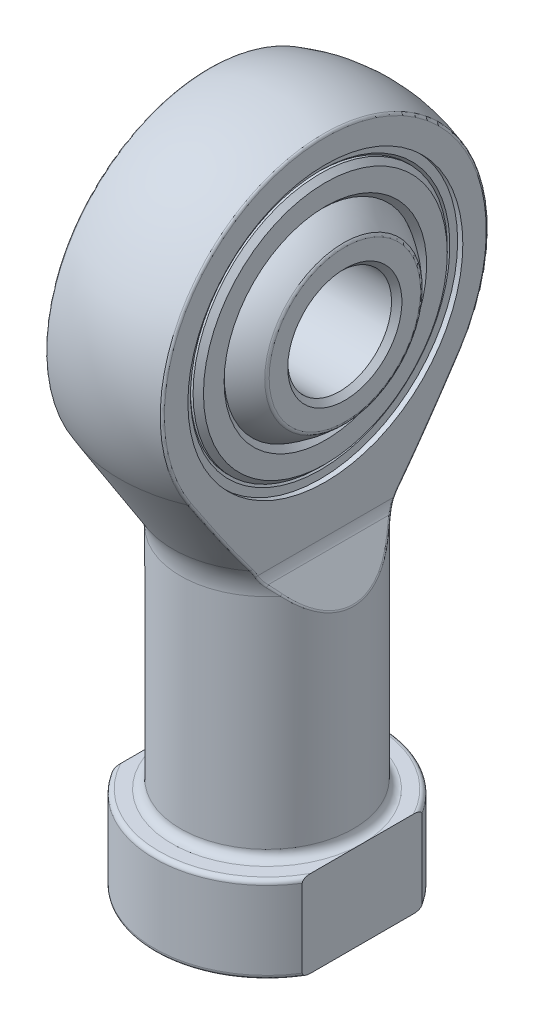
SolidWorks part; units mm, degrees
ref_plane "Plan de face" through (0, 0, 0) normal (0, 0, 1) x (1, 0, 0)
ref_plane "Plan de dessus" through (0, 0, 0) normal (0, 1, 0) x (1, 0, 0)
ref_plane "Plan de droite" through (0, 0, 0) normal (1, 0, 0) x (0, 0, -1)
sketch "Esquisse1" plane through (0, 0, 0) normal (0, 0, 1) x (1, 0, 0)
  line L0 (0, 0) -> (74.526, 0) construction
  line L1 (-36.595, 12) -> (48.607, 12) construction
  line L2 (-4.5, 4.3758) -> (-4.5, 3.3)
  line L3 (-4.2, 3) -> (4.2, 3)
  line L4 (4.5, 4.3758) -> (4.5, 3.3)
  line L5 (4.2, 3) -> (4.5, 3.3)
  line L6 (-4.5, 3.3) -> (-4.2, 3)
  arc A0 (4.4242, 4.5551) -> (-4.4242, 4.5551) centre (0, 0) ccw
  arc A1 (-4.4242, 4.5551) -> (-4.5, 4.3758) centre (-4.25, 4.3758) ccw
  arc A2 (4.4242, 4.5551) -> (4.5, 4.3758) centre (4.25, 4.3758) cw
  point P4 (4.5, 3)
  point P5 (-4.5, 3)
  dimension "D5" = 6.35
  dimension "D6" = 0.25
  dimension "D1" = 3
  dimension "D2" = 12
  dimension "D3" = 9
  dimension "D4" = 4.5
  dimension "D7" = 8.7516
revolve "Révolution1" add sketch "Esquisse1" angle 360 about L0
sketch "Esquisse6" plane through (0, 0, 0) normal (0, 0, 1) x (1, 0, 0)
  line L0 (0, 0) -> (7.0324, 0) construction
  line L1 (-3.075, 7.35) -> (3.075, 7.35)
  line L2 (-3.375, 7.05) -> (-3.375, 5.8558)
  line L3 (-3.075, 7.35) -> (-3.375, 7.05)
  line L4 (3.375, 7.05) -> (3.375, 5.8558)
  line L5 (3.075, 7.35) -> (3.375, 7.05)
  line L6 (3.375, 5.8558) -> (3.075, 5.5558)
  line L7 (-3.075, 5.5558) -> (-3.375, 5.8558)
  arc A0 (4.4242, 4.5551) -> (-4.4242, 4.5551) centre (0, 0) ccw construction
  arc A1 (3.075, 5.5558) -> (-3.075, 5.5558) centre (0, 0) ccw
  point P7 (-3.375, 7.35)
  point P13 (3.375, 7.35)
  dimension "D1" = 3.375
  dimension "D2" = 6.75
  dimension "D3" = 7.35
revolve "Révolution3" add sketch "Esquisse6" angle 360 about L0
sketch "Esquisse2" plane through (0, 0, 0) normal (0, 0, 1) x (1, 0, 0)
  line L0 (0, 10) -> (0, 5)
  line L5 (-5, -11.8435) -> (-5, -24.5)
  line L6 (-5.5, -25) -> (-6.25, -25)
  line L7 (-6.5, -25.25) -> (-6.5, -29.75)
  line L8 (-6.25, -30) -> (-3, -30)
  line L9 (0, -5) -> (0, -13.2679)
  line L10 (-8.5346, -5.2115) -> (-5.4396, -10.2801)
  line L11 (-3, -30) -> (-3, -15)
  line L12 (-3, -15) -> (0, -13.2679)
  arc A0 (-5, -24.5) -> (-5.5, -25) centre (-5.5, -24.5) cw
  arc A1 (0, 10) -> (-8.5346, -5.2115) centre (0, 0) ccw
  arc A2 (-6.5, -29.75) -> (-6.25, -30) centre (-6.25, -29.75) ccw
  arc A3 (-6.25, -25) -> (-6.5, -25.25) centre (-6.25, -25.25) ccw
  arc A4 (-5, -11.8435) -> (-5.4396, -10.2801) centre (-8, -11.8435) ccw
  arc A8 (0, 5) -> (0, -5) centre (0, 0) ccw
  point P7 (-6.5, -30)
  point P17 (-6.5, -25)
  point P20 (-5, -11)
  dimension "D1" = 20
  dimension "D10" = 0.5
  dimension "D11" = 0.25
  dimension "D12" = 3
  dimension "D16" = 5
  dimension "D7" = 15
  dimension "D2" = 11
  dimension "D3" = 5
  dimension "D4" = 6.5
  dimension "D5" = 5
  dimension "D6" = 30
  dimension "D8" = 120
  dimension "D9" = 3
revolve "Révolution2" add sketch "Esquisse2" angle 360 about L0
sketch "Esquisse3" plane through (0, 0, 0) normal (0, 0, 1) x (1, 0, 0)
  line L0 (-3.375, 21.1469) -> (-3.375, -10.6847)
  line L1 (-3.5558, -11.2583) -> (-5.5, -14.0348)
  line L2 (-5.5, -14.0348) -> (-5.5, -47.713)
  line L3 (-5.5, -47.713) -> (-20.4695, -48.711)
  line L4 (-20.4695, -48.711) -> (-20.4695, 21.1469)
  line L5 (-20.4695, 21.1469) -> (-3.375, 21.1469)
  line L6 (0, 0) -> (0, 23.9861) construction
  line L7 (20.4695, 21.1469) -> (3.375, 21.1469)
  line L8 (20.4695, -48.711) -> (20.4695, 21.1469)
  line L9 (5.5, -47.713) -> (20.4695, -48.711)
  line L10 (5.5, -14.0348) -> (5.5, -47.713)
  line L11 (3.5558, -11.2583) -> (5.5, -14.0348)
  line L12 (3.375, 21.1469) -> (3.375, -10.6847)
  arc A0 (-3.375, -10.6847) -> (-3.5558, -11.2583) centre (-4.375, -10.6847) cw
  arc A1 (3.375, -10.6847) -> (3.5558, -11.2583) centre (4.375, -10.6847) ccw
  point P9 (-3.375, -11)
  dimension "D5" = 1
  dimension "D1" = 5.5
  dimension "D2" = 35
  dimension "D3" = 3.375
  dimension "D4" = 11
extrude "Enlèv. mat.-Extru.1" cut sketch "Esquisse3" against normal mid plane 50
sketch "Esquisse7" plane through (-3.375, 0, 0) normal (-1, 0, 0) x (0, 0, 1)
  circle A1 centre (0, 0) radius 7.35 construction
  circle A2 centre (0, 0) radius 7.35
extrude "Enlèv. mat.-Extru.3" cut sketch "Esquisse7" against normal blind 50
sketch "Esquisse8" plane through (-3.375, 0, 0) normal (-1, 0, 0) x (0, 0, 1)
  arc A4 (7.95, 0) -> (7.95, 0) centre (0, 0) ccw
  circle A5 centre (0, 0) radius 7.95
  dimension "D1" = 0.6
extrude "Enlèv. mat.-Extru.4" cut sketch "Esquisse8" against normal blind 0.3
sketch "Esquisse9" plane through (3.375, 0, 0) normal (1, 0, 0) x (0, 0, -1)
  circle A1 centre (0, 0) radius 7.95 construction
  circle A2 centre (0, 0) radius 7.95
extrude "Enlèv. mat.-Extru.5" cut sketch "Esquisse9" against normal blind 0.3
chamfer "Chanfrein1" distance 0.15 angle 45 2 edges at (3.075, 7.35, 0) (-3.075, -7.35, 0)
fillet "Congé2" radius 0.15 20 edges at (-3.375, 9.4133, 0) (3.375, 9.4133, 0) (-3.375, -13.547, -9.9105) (-3.375, -13.3581, 10.0374) (-5, -13.3207, 0) (5, -13.3207, 0) (-3.4682, -11.1063, -3.7283) (-3.3934, -10.8754, 3.8879) (3.4682, -11.1063, 3.7283) (3.3934, -10.8754, -3.8879)
